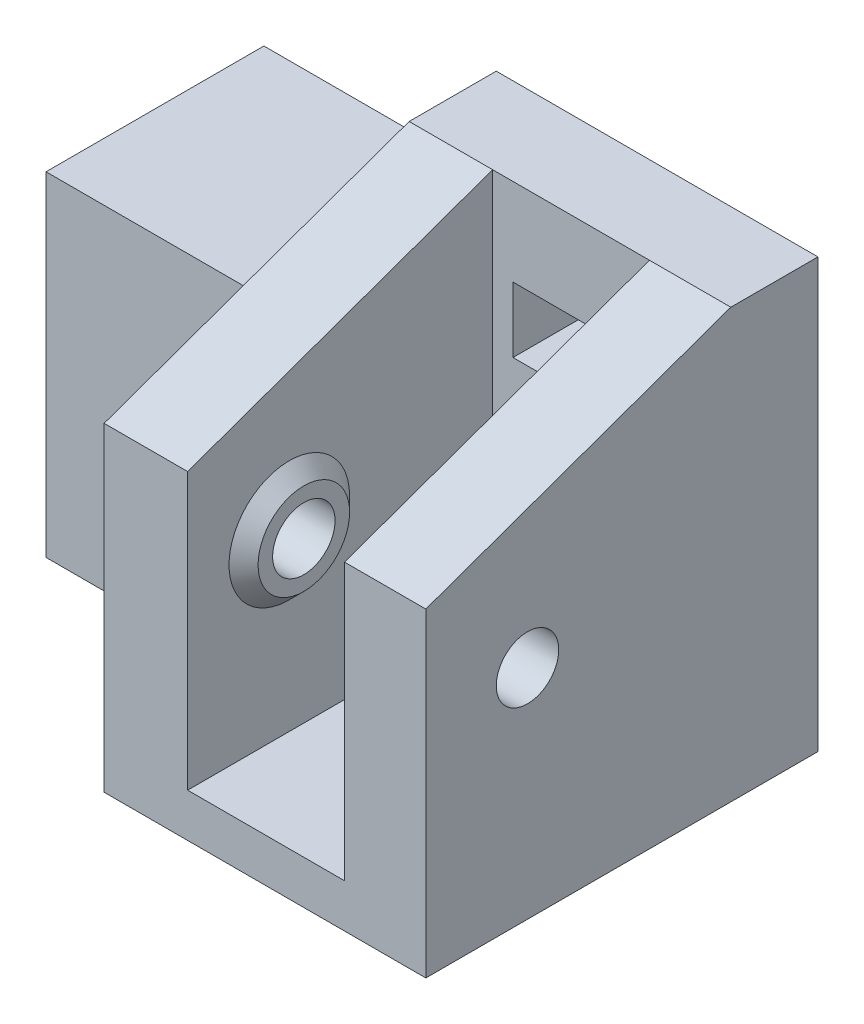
SolidWorks part; units mm, degrees
other "<Fijacion del marco con soporte para polea A>-<Saliente-Extruir8>"
ref_plane "Alzado" through (0, 0, 0) normal (0, 0, 1) x (1, 0, 0)
ref_plane "Planta" through (0, 0, 0) normal (0, 1, 0) x (1, 0, 0)
ref_plane "Vista lateral" through (0, 0, 0) normal (1, 0, 0) x (0, 0, -1)
ref_plane "Alzado-Fijacion del marco con soporte para polea A_Simétrica" through (0, 0, -10) normal (0, 0, -1) x (1, 0, 0)
ref_plane "Planta-Fijacion del marco con soporte para polea A_Simétrica" through (0, 0, -10) normal (0, 1, 0) x (1, 0, 0)
ref_plane "Vista lateral-Fijacion del marco con soporte para polea A_Simétrica" through (0, 0, -10) normal (1, 0, 0) x (0, 0, 1)
mirrored part "Fijacion del marco con soporte para polea A_Simétrica" parameters "D1.Saliente-Extruir1"=10, "D1.Croquis1"=8, "D2.Croquis1"=16, "D3.Croquis1"=8, "D4.Croquis1"=15, "D1.Saliente-Extruir2"=5, "D1.Croquis2"=0, "D1.Saliente-Extruir3"=6, "D1.Croquis3"=8, "D2.Croquis3"=8, "D3.Croquis3"=19.15, "D4.Croquis3"=4, "D6.Croquis3"=8.5, "D5.Croquis3"=11, "D7.Croquis3"=6.5, "D1.Saliente-Extruir4"=5.6, "D1.Croquis4"=4.3, "D2.Croquis4"=14, "D3.Croquis4"=7, "D4.Croquis4"=7, "D19.Saliente-Extruir5"=10.8, "D1.Croquis5"=0, "D1.Saliente-Extruir6"=1, "D1.Croquis6"=1, "D1.Saliente-Extruir7"=1, "D1.Croquis7"=0, "D1.Chaflán1"=1, "D2.Chaflán1"=45, "D1.Saliente-Extruir8"=3
